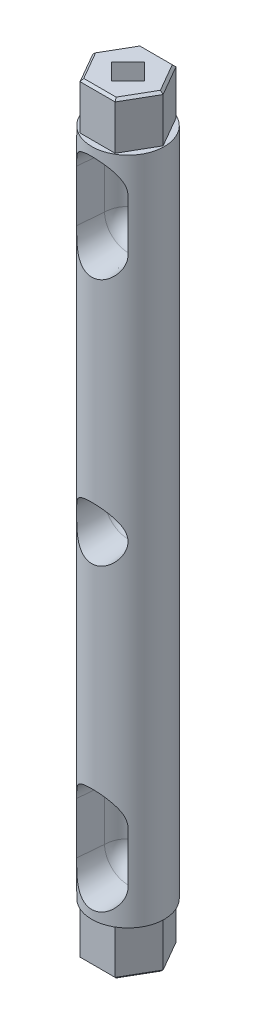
SolidWorks part; units mm, degrees
ref_plane "Front Plane" through (0, 0, 0) normal (0, 0, 1) x (1, 0, 0)
ref_plane "Top Plane" through (0, 0, 0) normal (0, 1, 0) x (1, 0, 0)
ref_plane "Right Plane" through (0, 0, 0) normal (1, 0, 0) x (0, 0, -1)
sketch "Sketch1" plane through (0, 0, 0) normal (0, 1, 0) x (1, 0, 0)
  circle A0 centre (0, 0) radius 7.75
extrude "Boss-Extrude1" add sketch "Sketch1" along normal blind 143
sketch "Sketch2" plane through (0, 0, 0) normal (0, 0, 1) x (1, 0, 0)
  line L0 (0, 143) -> (0, 135.5) construction
  line L1 (7.75, 143) -> (-7.75, 143) construction
  line L2 (0, 143) -> (0, 0) construction
  line L3 (7.75, 71.5) -> (-7.75, 71.5) construction
  line L4 (0, 135.5) -> (0, 125.5) construction
  line L5 (-5, 135.5) -> (-5, 125.5)
  line L6 (5, 135.5) -> (5, 125.5)
  line L7 (7.75, 0) -> (7.75, 143) construction
  line L8 (0, 17.5) -> (0, 18.5) construction
  line L9 (0, 7.5) -> (0, 17.5) construction
  line L10 (0, 125.5) -> (0, 124.5) construction
  line L11 (5, 125.5) -> (5, 124.5)
  line L12 (-5, 125.5) -> (-5, 124.5)
  line L13 (-7.75, 143) -> (-7.75, 0) construction
  line L14 (-5, 17.5) -> (-5, 18.5)
  line L15 (5, 17.5) -> (5, 18.5)
  line L16 (5, 7.5) -> (5, 17.5)
  line L17 (-5, 7.5) -> (-5, 17.5)
  arc A0 (5, 135.5) -> (-5, 135.5) centre (0, 135.5) ccw
  circle A1 centre (0, 71.5) radius 5
  arc A2 (-5, 18.5) -> (5, 18.5) centre (0, 18.5) cw
  arc A3 (5, 7.5) -> (-5, 7.5) centre (0, 7.5) cw
  arc A5 (-5, 124.5) -> (5, 124.5) centre (0, 124.5) ccw
  dimension "D1" = 10
  dimension "D2" = 1
  dimension "D4" = 7.5
extrude "Cut-Extrude1" cut sketch "Sketch2" along normal through all draft 5
ref_axis "Axis1" through (0, 143, 0) along (0, -1, 0)
sketch "Sketch3" plane through (0, 0, 0) normal (0, 0, 1) x (1, 0, 0)
  line L0 (-5, 18.5) -> (5, 18.5) construction
  line L1 (-0.527, 78.6715) -> (-0.527, 65.5095) construction
  line L2 (0, 140.5) -> (0, 130)
  line L3 (0, 135.5) -> (0, 124.5) construction
  line L4 (5, 135.5) -> (5, 124.5)
  line L5 (0, 130) -> (0, 119.5)
  line L6 (0, 7.5) -> (0, 23.5)
  line L7 (5, 18.5) -> (5, 7.5)
  line L8 (-5, 120.66) -> (5, 120.66) construction
  line L9 (0, 7.5) -> (0, 2.5)
  line L10 (-5, 124.5) -> (5, 124.5) construction
  line L11 (0, 143) -> (0, 0) construction
  line L12 (5.4795, 7.5) -> (5, 7.5) construction
  line L13 (5, 124.5) -> (5, 135.5) construction
  line L14 (-5, 7.5) -> (5, 7.5) construction
  line L15 (7.75, 143) -> (-7.75, 143) construction
  line L16 (0, 76.5) -> (0, 66.5)
  arc A0 (5, 135.5) -> (0, 140.5) centre (0, 135.5) ccw
  arc A1 (-0.527, 65.5095) -> (-0.527, 78.6715) centre (-0.527, 72.0905) ccw construction
  arc A2 (5, 18.5) -> (0, 23.5) centre (0, 18.5) ccw
  arc A3 (0, 119.5) -> (5, 124.5) centre (0, 124.5) ccw
  arc A4 (5, 7.5) -> (0, 2.5) centre (0, 7.5) cw
  arc A5 (0, 66.5) -> (0, 76.5) centre (0, 71.5) ccw
revolve "Cut-Revolve1" cut sketch "Sketch3" angle 360 about axis through (0, 143, 0) along (0, -1, 0)
sketch "Sketch4" plane through (0, 143, 0) normal (0, 1, 0) x (1, 0, 0)
  line L1 (7.5, 0) -> (3.75, 6.4952)
  line L2 (3.75, 6.4952) -> (-3.75, 6.4952)
  line L3 (-3.75, 6.4952) -> (-7.5, 0)
  line L4 (-7.5, 0) -> (-3.75, -6.4952)
  line L5 (-3.75, -6.4952) -> (3.75, -6.4952)
  line L6 (3.75, -6.4952) -> (7.5, 0)
  circle A0 centre (0, 0) radius 6.4952 construction
extrude "Boss-Extrude2" add sketch "Sketch4" along normal blind 10
sketch "Sketch5" plane through (0, 0, 0) normal (0, -1, 0) x (-1, 0, 0)
  line L1 (-7.5, 0) -> (-3.75, -6.4952)
  line L2 (-3.75, -6.4952) -> (3.75, -6.4952)
  line L3 (3.75, -6.4952) -> (7.5, 0)
  line L4 (7.5, 0) -> (3.75, 6.4952)
  line L5 (3.75, 6.4952) -> (-3.75, 6.4952)
  line L6 (-3.75, 6.4952) -> (-7.5, 0)
  circle A0 centre (0, 0) radius 6.4952 construction
extrude "Boss-Extrude3" add sketch "Sketch5" along normal blind 10
hole_wizard "#12 (0.189) Diameter Hole1" positions "Sketch7" profile "Sketch6" hole size "#12" standard "ANSI Inch"
sketch "Sketch7" plane through (0, 153, 0) normal (0, 1, 0) x (1, 0, 0)
  point P0 (0, 0)
sketch "Sketch6" plane through (0, 153, 0) normal (1, 0, 0) x (0, 0, 1)
  line L0 (0, 0) -> (0, 6.4422)
  line L1 (0, 6.4422) -> (2.4003, 5)
  line L2 (2.4003, 5) -> (2.4003, 0)
  line L5 (2.4003, 0) -> (0, 0)
  line L10 (0, 6.4422) -> (-2.4003, 5) construction
  line L11 (0, -6.35) -> (0, 107.95) construction
  dimension "Hole Dia." = 4.8006
  dimension "Hole Depth" = 5
  dimension "Drill Angle" = 118
hole_wizard "#12 (0.189) Diameter Hole2" positions "Sketch10" profile "Sketch9" hole size "#12" standard "ANSI Inch"
sketch "Sketch10" plane through (0, -10, 0) normal (0, -1, 0) x (-1, 0, 0)
  point P0 (0, 0)
sketch "Sketch9" plane through (0, -10, 0) normal (1, 0, 0) x (0, 0, -1)
  line L0 (0, 0) -> (0, 6.4422)
  line L1 (0, 6.4422) -> (2.4003, 5)
  line L2 (2.4003, 5) -> (2.4003, 0)
  line L5 (2.4003, 0) -> (0, 0)
  line L10 (0, 6.4422) -> (-2.4003, 5) construction
  line L11 (0, -6.35) -> (0, 107.95) construction
  dimension "Hole Dia." = 4.8006
  dimension "Hole Depth" = 5
  dimension "Drill Angle" = 118
sketch "Sketch11" plane through (0, 153, 0) normal (0, 1, 0) x (1, 0, 0)
  line L0 (0, 4.4419) -> (0, -4.4225) construction
  line L1 (-4.1212, 0) -> (4.1989, 0) construction
  line L2 (0, 3.4876) -> (3.4876, 0) construction
  line L3 (0, 3.4876) -> (3.4876, 0)
  line L4 (3.4876, 0) -> (0, -3.4876)
  line L5 (0, -3.4876) -> (-3.4876, 0)
  line L6 (-3.4876, 0) -> (0, 3.4876)
  circle A0 centre (0, 0) radius 2.4574 construction
extrude "Cut-Extrude2" cut sketch "Sketch11" against normal blind 10
sketch "Sketch12" plane through (0, -10, 0) normal (0, -1, 0) x (-1, 0, 0)
  line L0 (0, -3.4876) -> (-3.4876, 0)
  line L1 (-3.4876, 0) -> (0, 3.4876)
  line L2 (0, 3.4876) -> (3.4876, 0)
  line L3 (3.4876, 0) -> (0, -3.4876)
extrude "Cut-Extrude3" cut sketch "Sketch12" against normal blind 10
chamfer "Chamfer1" distance 0.5 angle 45 6 edges at (0, 153, 6.4952) (-5.625, 153, 3.2476) (-5.625, 153, -3.2476) (0, 153, -6.4952) (5.625, 153, -3.2476) (5.625, 153, 3.2476)
chamfer "Chamfer2" distance 0.5 angle 45 6 edges at (-5.625, -10, 3.2476) (-5.625, -10, -3.2476) (0, -10, -6.4952) (5.625, -10, -3.2476) (5.625, -10, 3.2476) (0, -10, 6.4952)
